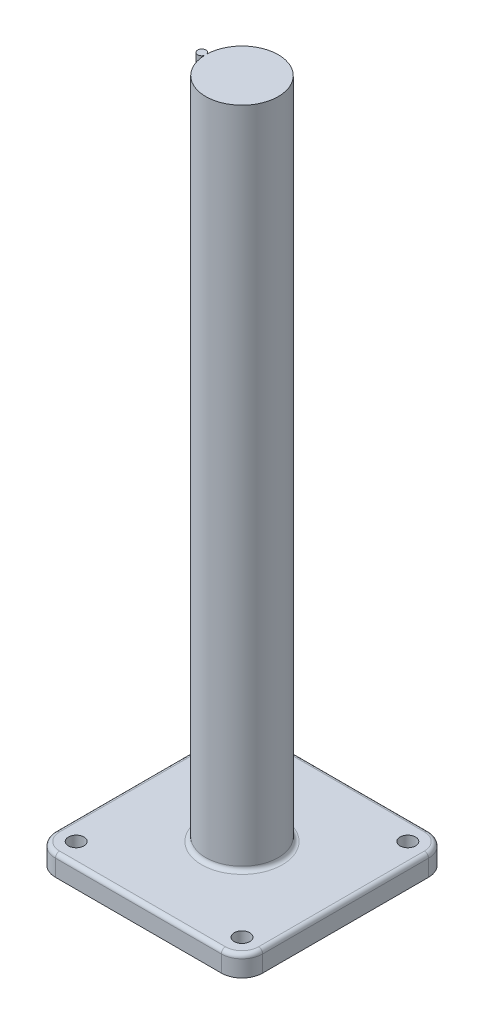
SolidWorks part; units mm, degrees
ref_plane "Front Plane" through (0, 0, 0) normal (0, 0, 1) x (1, 0, 0)
ref_plane "Top Plane" through (0, 0, 0) normal (0, 1, 0) x (1, 0, 0)
ref_plane "Right Plane" through (0, 0, 0) normal (1, 0, 0) x (0, 0, -1)
sketch "Sketch1" plane through (0, 0, 0) normal (0, 1, 0) x (1, 0, 0)
  line L0 (-63.5, -63.5) -> (63.5, 63.5) construction
  line L1 (-50.8, -63.5) -> (50.8, -63.5)
  line L2 (-63.5, -50.8) -> (-63.5, 50.8)
  line L3 (-50.8, 63.5) -> (50.8, 63.5)
  line L4 (63.5, -50.8) -> (63.5, 50.8)
  arc A0 (50.8, -63.5) -> (63.5, -50.8) centre (50.8, -50.8) ccw
  arc A1 (50.8, 63.5) -> (63.5, 50.8) centre (50.8, 50.8) cw
  arc A2 (-63.5, 50.8) -> (-50.8, 63.5) centre (-50.8, 50.8) cw
  arc A3 (-50.8, -63.5) -> (-63.5, -50.8) centre (-50.8, -50.8) cw
  circle A4 centre (-50.8, 50.8) radius 4.7625
  circle A5 centre (50.8, 50.8) radius 4.7625
  circle A6 centre (50.8, -50.8) radius 4.7625
  circle A7 centre (-50.8, -50.8) radius 4.7625
  point P11 (-63.5, 63.5)
  dimension "D3" = 12.7
  dimension "D4" = 9.525
  dimension "D1" = 127
  dimension "D2" = 127
extrude "Extrude1" add sketch "Sketch1" along normal blind 12.7
sketch "Sketch3" plane through (0, 0, 0) normal (0, 0, 1) x (1, 0, 0)
  line L0 (0, 0) -> (0, 245.8061) construction
  line L1 (0, 419.1) -> (22.225, 419.1)
  line L6 (22.225, 419.1) -> (22.225, 12.7)
  line L7 (22.225, 12.7) -> (0, 12.7)
  line L9 (-50.8, 12.7) -> (50.8, 12.7) construction
  line L10 (0, 419.1) -> (0, 12.7)
  dimension "D1" = 406.4
  dimension "D2" = 22.225
revolve "Revolve1" add sketch "Sketch3" angle 360 about L0
fillet "Fillet2" radius 2.54 9 edges at (-59.7803, 12.7, 59.7803) (-63.5, 12.7, 0) (-59.7803, 12.7, -59.7803) (0, 12.7, -63.5) (59.7803, 12.7, -59.7803) (63.5, 12.7, 0) (59.7803, 12.7, 59.7803) (0, 12.7, 63.5) (0, 12.7, 22.225)
sketch "Sketch4" plane through (0, 419.1, 0) normal (0, 1, 0) x (-1, 0, 0)
  circle A0 centre (24.638, 0) radius 2.54
  dimension "D1" = 5.08
  dimension "D2" = 24.638
extrude "Extrude2" add sketch "Sketch4" against normal up to surface (406.4 mm away)
